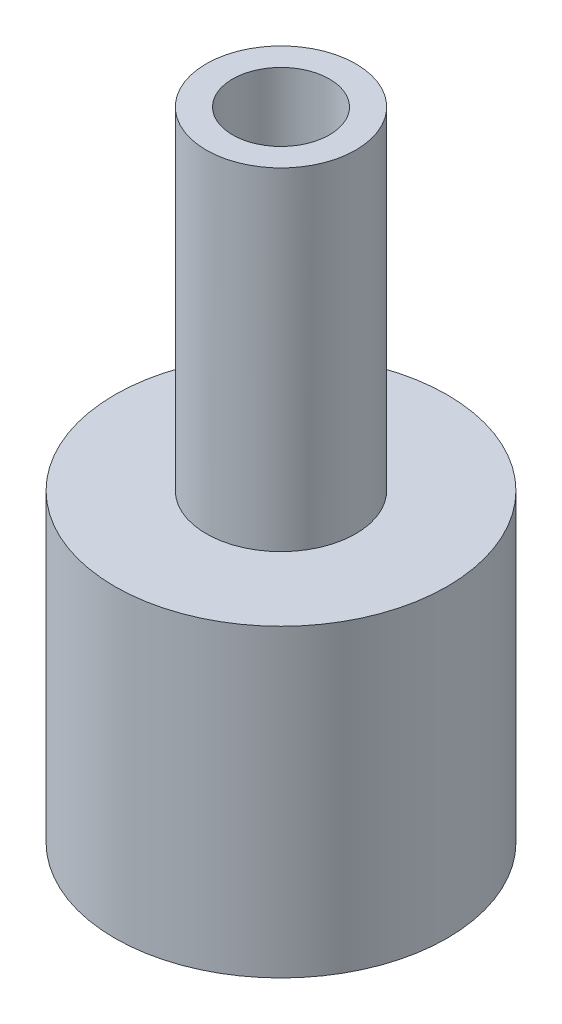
SolidWorks part; units mm, degrees
ref_plane "Front Plane" through (0, 0, 0) normal (0, 0, 1) x (1, 0, 0)
ref_plane "Top Plane" through (0, 0, 0) normal (0, 1, 0) x (1, 0, 0)
ref_plane "Right Plane" through (0, 0, 0) normal (1, 0, 0) x (0, 0, -1)
sketch "Sketch1" plane through (0, 0, 0) normal (0, 1, 0) x (1, 0, 0)
  circle A0 centre (0, 0) radius 1.35
  dimension "D1" = 2.7
extrude "Boss-Extrude1" add sketch "Sketch1" along normal mid plane 11.5 contours A0
sketch "Sketch2" plane through (0, -5.75, 0) normal (0, -1, 0) x (1, 0, 0)
  circle A0 centre (0, 0) radius 3
  dimension "D1" = 6
extrude "Boss-Extrude2" add sketch "Sketch2" against normal blind 5.5
sketch "Sketch3" plane through (0, -5.75, 0) normal (0, -1, 0) x (1, 0, 0)
  circle A0 centre (0, 0) radius 0.875
  dimension "D1" = 1.75
extrude "Cut-Extrude1" cut sketch "Sketch3" against normal through all both and the other way through all
